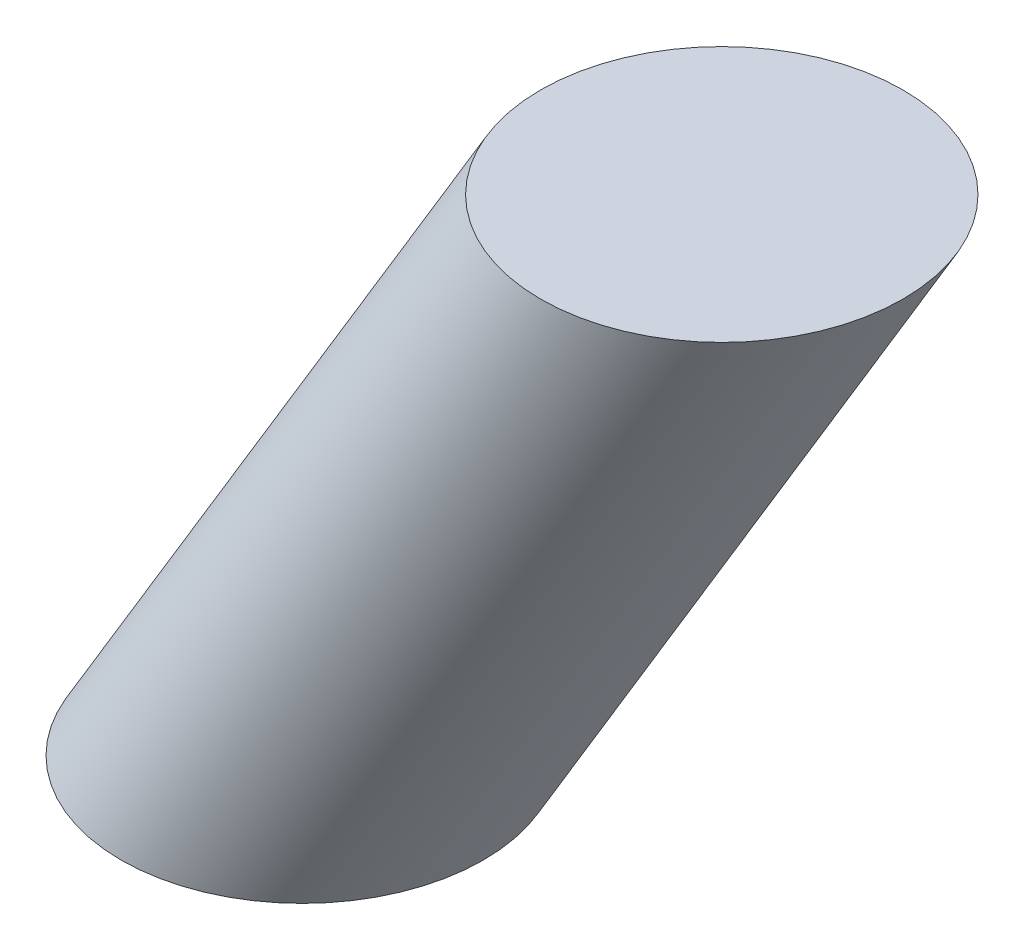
SolidWorks part; units mm, degrees
ref_plane "Front Plane" through (0, 0, 0) normal (0, 0, 1) x (1, 0, 0)
ref_plane "Top Plane" through (0, 0, 0) normal (0, 1, 0) x (1, 0, 0)
ref_plane "Right Plane" through (0, 0, 0) normal (1, 0, 0) x (0, 0, -1)
sketch "Sketch1" plane through (0, 0, 0) normal (0, 0, 1) x (1, 0, 0)
  line L0 (0, 0) -> (51.4868, 85.3647)
sketch "Sketch2" plane through (0, 0, 0) normal (0, 1, 0) x (1, 0, 0)
  circle A0 centre (0, 0) radius 22.2342
sweep "Sweep1" add profiles "Sketch2" path "Sketch1"
